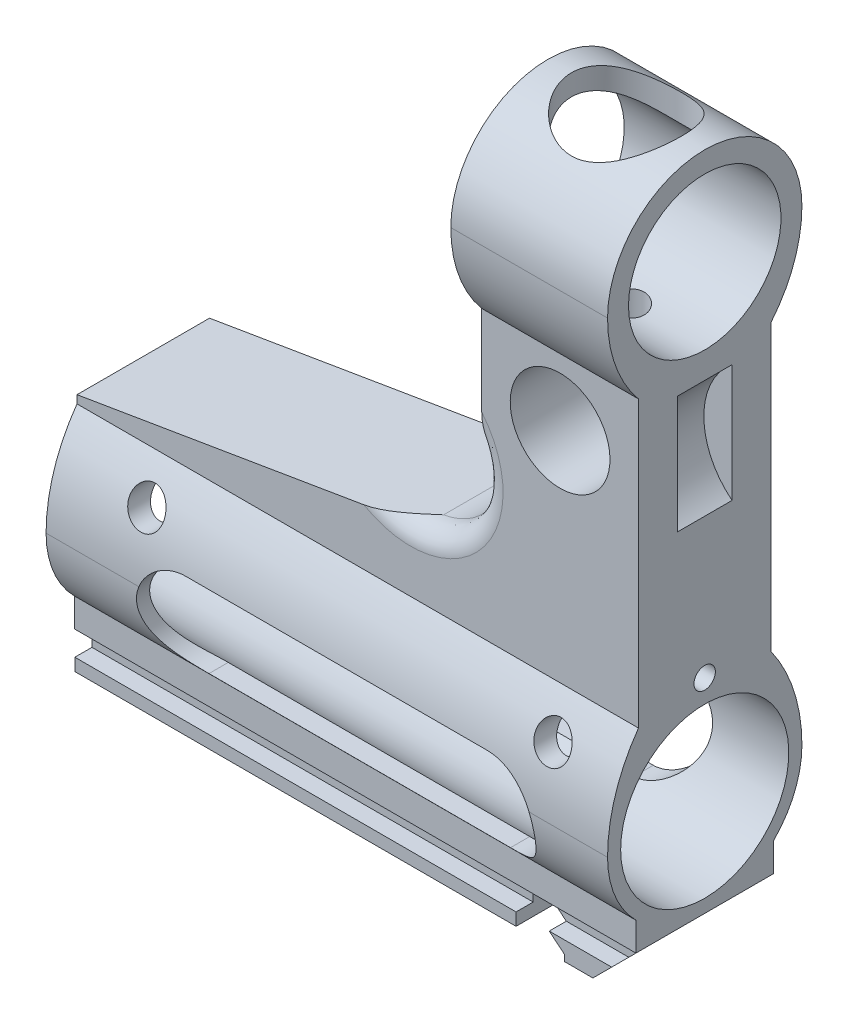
SolidWorks part; units mm, degrees
ref_plane "Front Plane" through (0, 0, 0) normal (0, 0, 1) x (1, 0, 0)
ref_plane "Top Plane" through (0, 0, 0) normal (0, 1, 0) x (1, 0, 0)
ref_plane "Right Plane" through (0, 0, 0) normal (1, 0, 0) x (0, 0, -1)
sketch "Sketch1" plane through (0, 0, 0) normal (0, 0, 1) x (1, 0, 0)
  line L0 (12.2174, 10.922) -> (39.0893, 10.922) construction
  line L2 (0, 0.5653) -> (0, 21.844)
  line L3 (46.1645, 0) -> (50.038, 3.8735)
  line L4 (12.2174, 15.1892) -> (39.0893, 15.1892)
  line L5 (50.038, 0) -> (50.165, 0)
  line L6 (50.038, 3.8735) -> (50.038, 62.8142)
  line L7 (50.038, 62.8142) -> (36.068, 62.8142)
  line L8 (36.068, 33.2635) -> (36.068, 62.8142)
  line L9 (12.2174, 6.6548) -> (39.0893, 6.6548)
  line L10 (0, 21.844) -> (30.7677, 27.0008)
  line L11 (50.038, 0) -> (50.165, 0)
  line L12 (46.1645, 0) -> (43.6245, 0)
  line L13 (43.6245, 0) -> (43.6245, 0.5653)
  line L14 (41.2242, 2.54) -> (39.3192, 2.54)
  line L15 (39.3192, 2.54) -> (39.3192, 0.5653)
  line L16 (43.6245, 0.5653) -> (41.2242, 2.54)
  line L17 (39.3192, 0.5653) -> (0, 0.5653)
  line L18 (43.6245, 0) -> (46.1645, 0)
  arc A0 (12.2174, 15.1892) -> (12.2174, 6.6548) centre (12.2174, 10.922) ccw
  arc A1 (39.0893, 6.6548) -> (39.0893, 15.1892) centre (39.0893, 10.922) ccw
  arc A2 (36.068, 33.2635) -> (30.7677, 27.0008) centre (29.718, 33.2635) cw
  circle A3 centre (7.9502, 17.927) radius 1.5875
  circle A4 centre (44.1452, 17.927) radius 1.5875
  point P10 (25.6534, 10.922)
  point P15 (7.9502, 10.922)
  point P16 (36.068, 27.8892)
  point P19 (36.068, 27.8892)
  point P24 (46.1645, 0)
  dimension "D9" = 6.35
  dimension "D10" = 3.175
  dimension "D11" = 3.175
  dimension "D1" = 8.5344
  dimension "D2" = 62.8142
  dimension "D3" = 7.9502
  dimension "D4" = 1.905
  dimension "D6" = 13.97
  dimension "D7" = 50.038
  dimension "D8" = 34.925
  dimension "D12" = 36.195
  dimension "D13" = 3.8735
  dimension "D14" = 10.7188
  dimension "D15" = 2.54
extrude "Boss-Extrude1" add sketch "Sketch1" along normal mid plane 17.3228 contours L8 A2 L10 L2 L17 L15 L14 L16 L13 L12 L3 L6 L7 A4 A3 A1 L9 A0 L4
ref_plane "Plane1" through (50.038, 0, 0) normal (1, 0, 0) x (0, 0, -1)
sketch "Sketch2" plane through (50.038, 0, 0) normal (1, 0, 0) x (0, 0, -1)
  line L0 (-8.6614, 62.8142) -> (8.6614, 62.8142) construction
  line L1 (-8.6614, 3.8735) -> (-8.6614, 62.8142) construction
  line L2 (8.6614, 3.8735) -> (8.6614, 62.8142) construction
  line L3 (0, 0) -> (0, 62.8142) construction
  line L4 (-8.6614, 3.8735) -> (8.6614, 3.8735) construction
  line L5 (-5.9055, 46.5328) -> (-5.9055, 21.1328)
  line L6 (-8.6614, 0) -> (8.6614, 0) construction
  line L7 (5.9055, 46.5328) -> (5.9055, 21.1328)
  line L9 (-4.572, 3.8735) -> (-4.572, 1.6764)
  line L10 (-4.572, 0) -> (4.572, 0)
  line L11 (4.572, 3.8735) -> (4.572, 1.6764)
  line L12 (-4.572, 3.8735) -> (-6.1285, 3.8735)
  line L13 (-6.1285, 3.8735) -> (-6.1285, 6.4143)
  line L14 (4.572, 3.8735) -> (6.1285, 3.8735)
  line L15 (6.1285, 3.8735) -> (6.1285, 6.4143)
  line L16 (-6.096, 0) -> (6.096, 0)
  line L17 (-6.096, 0) -> (-6.096, 1.6764)
  line L18 (-6.096, 1.6764) -> (-4.572, 1.6764)
  line L19 (6.096, 0) -> (6.096, 1.6764)
  line L20 (4.572, 1.6764) -> (6.096, 1.6764)
  line L22 (-21.733, 69.8384) -> (17.3488, 69.8384)
  line L23 (-21.733, 69.8384) -> (-21.733, -11.4393)
  line L24 (-21.733, -11.4393) -> (17.3488, -11.4393)
  line L25 (17.3488, 69.8384) -> (17.3488, -11.4393)
  arc A0 (8.6614, 54.1528) -> (-8.6614, 54.1528) centre (0, 54.1528) ccw
  arc A1 (-5.9055, 46.5328) -> (-8.6614, 54.1528) centre (3.2511, 54.1528) cw
  arc A2 (5.9055, 46.5328) -> (8.6614, 54.1528) centre (-3.2511, 54.1528) ccw
  circle A3 centre (0, 54.1528) radius 6.7945
  arc A4 (-8.6614, 12.5349) -> (-6.1285, 6.4143) centre (0, 12.5349) ccw
  arc A5 (-8.6614, 12.5349) -> (-5.9055, 21.1328) centre (6.1285, 12.5349) cw
  arc A6 (5.9055, 21.1328) -> (8.6614, 12.5349) centre (-6.1285, 12.5349) cw
  circle A7 centre (0, 12.5349) radius 7.493
  arc A8 (6.1285, 6.4143) -> (8.6614, 12.5349) centre (0, 12.5349) ccw
  dimension "D4" = 13.589
  dimension "D6" = 14.986
  dimension "D1" = 25.4
  dimension "D2" = 11.811
  dimension "D3" = 5.9055
  dimension "D5" = 7.62
  dimension "D7" = 12.192
  dimension "D8" = 9.144
  dimension "D9" = 4.572
  dimension "D10" = 6.096
  dimension "D11" = 2.1971
extrude "Cut-Extrude1" cut sketch "Sketch2" against normal mid plane 127 contours L25 L22 L23 L24 A8 L15 L14 L11 L20 L19 L16 L10 L17 L18 L9 L12 L13 A4 A5 L5 A1 A0 A2 L7 A6 | A3 L3 | L3 A3 | A7 L3 | L3 A7
fillet "Fillet1" radius 1.905 2 edges at (34.5651, 29.1612, 5.9055) (34.5651, 29.1612, -5.9055)
ref_plane "Plane2" through (0, 54.1528, 0) normal (0, 1, 0) x (1, 0, 0)
sketch "Sketch3" plane through (0, 54.1528, 0) normal (0, 1, 0) x (1, 0, 0)
  line L0 (36.068, -4.0005) -> (36.068, 4.0005) construction
  line L1 (50.038, -8.6614) -> (50.038, 8.6614) construction
  line L2 (36.068, -4.0005) -> (36.068, 4.0005)
  line L3 (50.038, -8.6614) -> (50.038, 8.6614)
  circle A0 centre (43.053, 0) radius 4.9022
  dimension "D2" = 9.8044
  dimension "D1" = 6.985
extrude "Cut-Extrude2" cut sketch "Sketch3" along normal blind 50.8 contours A0
sketch "Sketch4" plane through (50.038, 0, 0) normal (1, 0, 0) x (0, 0, -1)
  circle A4 centre (-0.0061, 22.0599) radius 0.9525
  dimension "D1" = 1.905
extrude "Cut-Extrude3" cut sketch "Sketch4" against normal blind 6.35
ref_plane "Plane3" through (0, 0, 0) normal (0, 0, 1) x (1, 0, 0)
sketch "Sketch6" plane through (0, 0, 0) normal (0, 0, 1) x (1, 0, 0)
  line L0 (50.038, 47.3583) -> (50.038, 60.9473) construction
  line L2 (50.038, 21.1328) -> (50.038, 46.5328) construction
  line L3 (50.038, 45.0088) -> (50.038, 34.5313)
  arc A0 (50.038, 45.0088) -> (50.038, 34.5313) centre (54.2377, 39.77) ccw
  point P2 (50.038, 45.0088)
  point P3 (50.038, 34.5313)
  point P9 (47.5234, 39.77)
  dimension "D1" = 2.3495
  dimension "D2" = 10.4775
  dimension "D3" = 2.5146
extrude "Cut-Extrude4" cut sketch "Sketch6" against normal mid plane 4.8641
sketch "Sketch7" plane through (0, 0, 0) normal (0, 0, 1) x (1, 0, 0)
  line L0 (36.068, 38.5382) -> (36.068, 46.5328) construction
  circle A0 centre (43.053, 40.5892) radius 4.445
  point P2 (36.068, 42.5355)
  dimension "D2" = 8.89
  dimension "D1" = 6.985
  dimension "D3" = 22.225
extrude "Cut-Extrude5" cut sketch "Sketch7" against normal mid plane 25.4
sketch "Sketch8" plane through (0, 54.1528, 0) normal (0, 1, 0) x (1, 0, 0)
  circle A2 centre (43.053, 0) radius 1.5875
  dimension "D1" = 3.175
extrude "Cut-Extrude6" cut sketch "Sketch8" against normal blind 13.081
